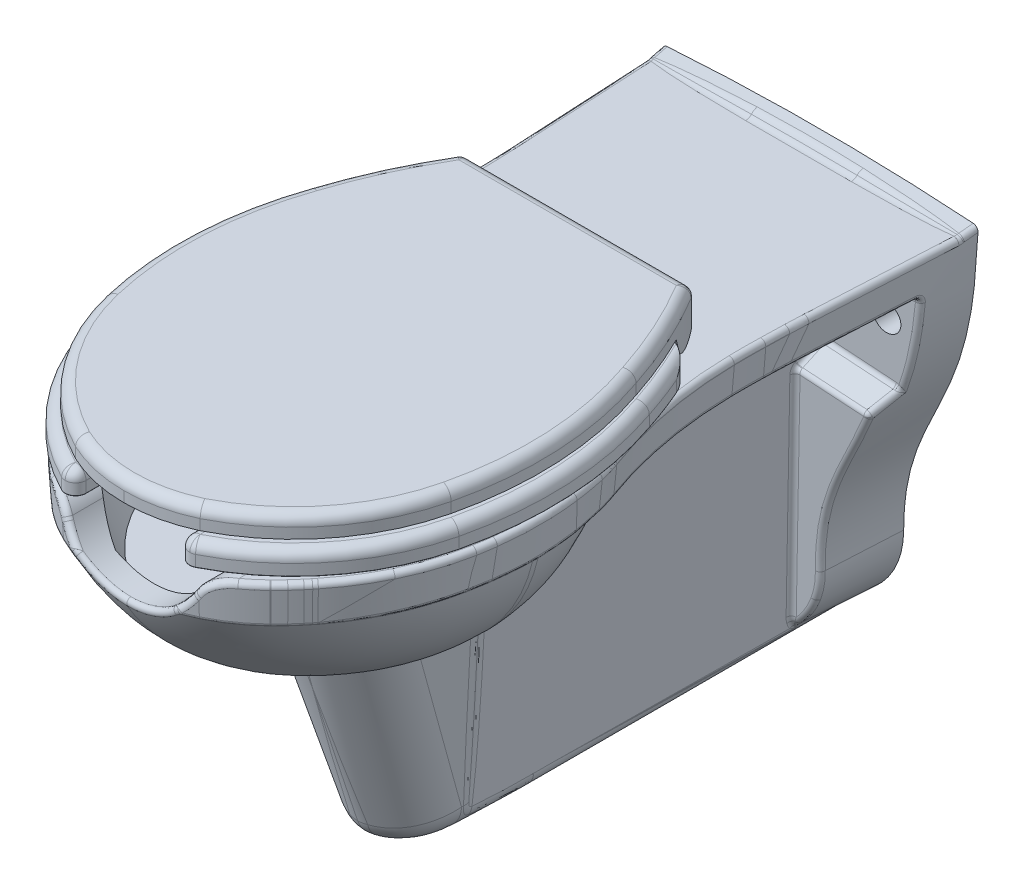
SolidWorks part; units mm, degrees
ref_plane "Ön Düzlem" through (0, 0, 0) normal (0, 0, 1) x (1, 0, 0)
ref_plane "Üst Düzlem" through (0, 0, 0) normal (0, 1, 0) x (1, 0, 0)
ref_plane "Sağ Düzlem" through (0, 0, 0) normal (1, 0, 0) x (0, 0, -1)
imported_body "BD320-00CB00E-0000+KC0403.01.0000E .STEP<1>"
imported_body "taharettt-yüzük.STEP<1>"
move or copy body "Gövde-Taşı/Kopyala1" bodies to move or copy 106 107 copy no translate (0, 0, 100.5954) parameters "D1"=0, "D2"=0, "D3"=100.5954
